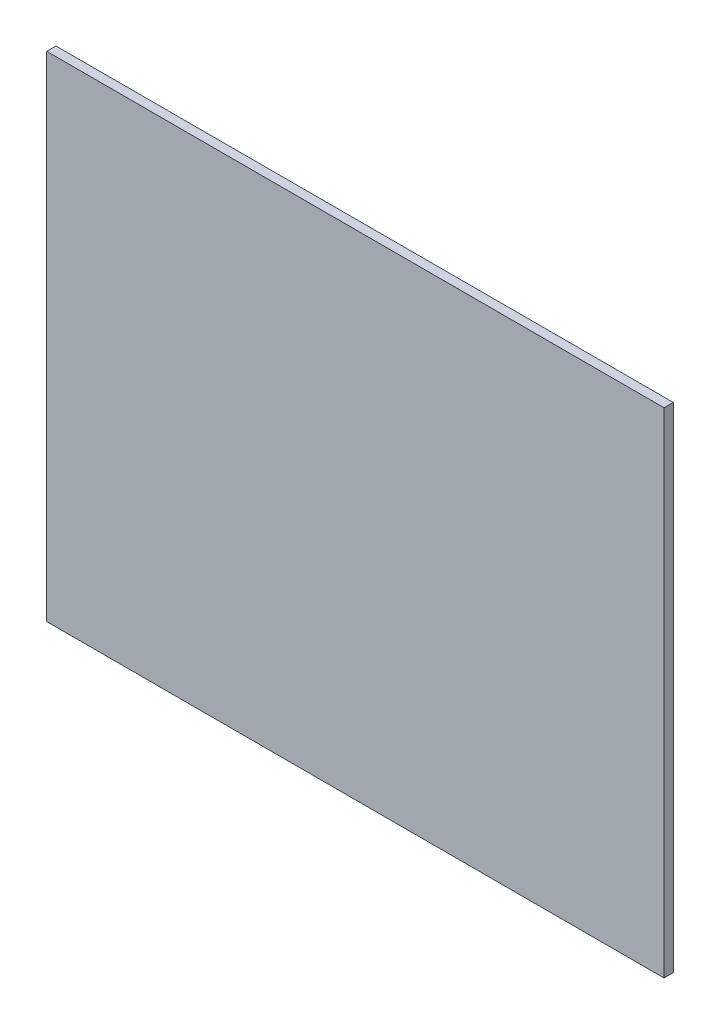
SolidWorks part; units mm, degrees
ref_plane "Front Plane" through (0, 0, 0) normal (0, 0, 1) x (1, 0, 0)
ref_plane "Top Plane" through (0, 0, 0) normal (0, 1, 0) x (1, 0, 0)
ref_plane "Right Plane" through (0, 0, 0) normal (1, 0, 0) x (0, 0, -1)
sketch "Sketch1" plane through (0, 0, 0) normal (0, 0, 1) x (1, 0, 0)
  line L1 (-100, 80) -> (100, 80)
  line L2 (-100, 80) -> (-100, -80)
  line L3 (-100, -80) -> (100, -80)
  line L4 (100, 80) -> (100, -80)
  line L5 (-100, 80) -> (100, -80) construction
  line L6 (-100, -80) -> (100, 80) construction
  point P0 (0, 0)
  dimension "D1" = 200
  dimension "D2" = 160
extrude "Boss-Extrude1" add sketch "Sketch1" along normal blind 3
sketch "Sketch3" plane through (0, 0, 0) normal (0, 0, -1) x (-1, 0, 0)
  line L0 (100, 80) -> (100, -80) construction
  line L1 (-100, -80) -> (100, -80)
  line L2 (-100, -80) -> (-100, -77)
  line L3 (-100, -77) -> (100, -77)
  line L4 (100, -80) -> (100, -77)
  dimension "D1" = 3
